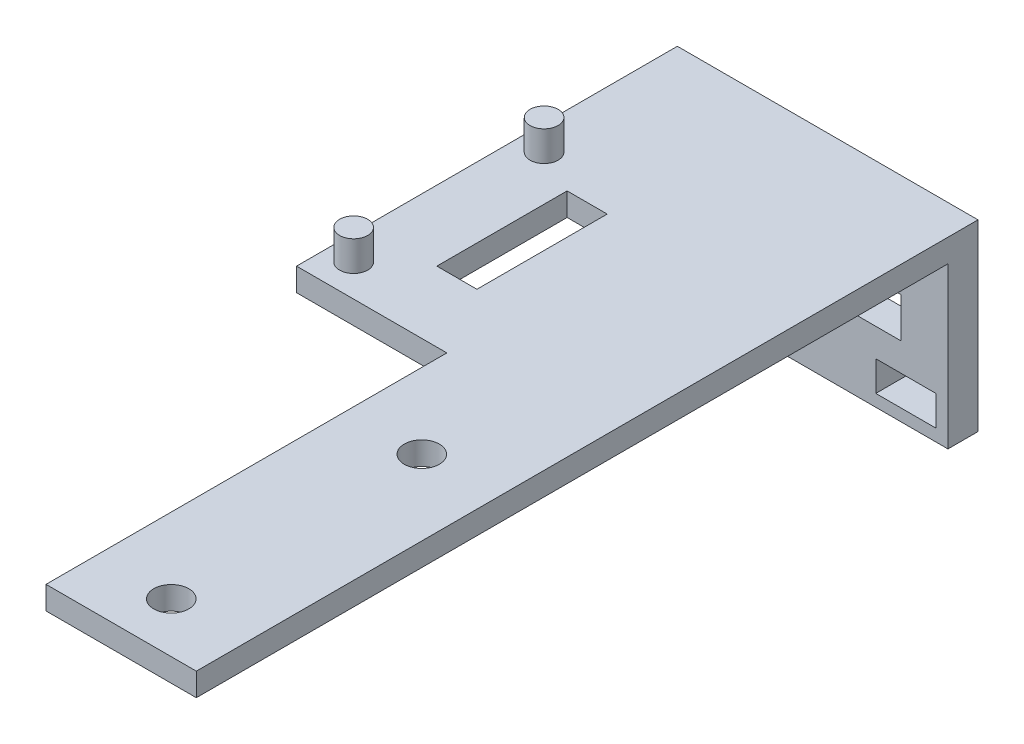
SolidWorks part; units mm, degrees
ref_plane "前视基准面" through (0, 0, 0) normal (0, 0, 1) x (1, 0, 0)
ref_plane "上视基准面" through (0, 0, 0) normal (0, 1, 0) x (1, 0, 0)
ref_plane "右视基准面" through (0, 0, 0) normal (1, 0, 0) x (0, 0, -1)
sketch "草图1" plane through (0, 0, 0) normal (0, 1, 0) x (1, 0, 0)
  line L0 (0, 47.4816) -> (0, -42.5568) construction
  line L2 (-7.5, 7.5) -> (-7.5, -32.5)
  line L3 (-7.5, -32.5) -> (7.5, -32.5)
  line L4 (7.5, 32.5) -> (7.5, -32.5)
  line L6 (-7.5, -32.5) -> (7.5, 32.5) construction
  line L9 (-7.5, 7.5) -> (-22.5, 7.5)
  line L10 (-22.5, 32.5) -> (-22.5, 7.5)
  line L12 (-15.5, 27.5) -> (-11.5, 27.5)
  line L13 (-15.5, 27.5) -> (-15.5, 14.5)
  line L14 (-15.5, 14.5) -> (-11.5, 14.5)
  line L15 (-11.5, 27.5) -> (-11.5, 14.5)
  line L16 (-15.5, 27.5) -> (-11.5, 14.5) construction
  line L17 (-15.5, 14.5) -> (-11.5, 27.5) construction
  line L19 (-22.5, 32.5) -> (-22.5, 45.5)
  line L20 (-22.5, 45.5) -> (7.5, 45.5)
  line L21 (7.5, 32.5) -> (7.5, 45.5)
  circle A0 centre (0, -27.5) radius 1.75
  circle A1 centre (0, -2.5) radius 1.75
  point P0 (0, 0)
  point P15 (-13.5, 21)
  point P22 (-15, 7.5)
  dimension "D5" = 3.5
  dimension "D6" = 3.5
  dimension "D10" = 22.5
  dimension "D11" = 48
  dimension "D1" = 15
  dimension "D2" = 65
  dimension "D3" = 25
  dimension "D4" = 13
  dimension "D7" = 7
  dimension "D8" = 20
  dimension "D9" = 7.5
  dimension "D12" = 7
  dimension "D13" = 11
  dimension "D14" = 38
  dimension "D15" = 73
extrude "凸台-拉伸1" add sketch "草图1" against normal blind 2.3
sketch "草图2" plane through (0, 0, 0) normal (0, 1, 0) x (1, 0, 0)
  line L0 (-55.6953, 0) -> (33.5451, 0) construction
  line L1 (0, 34.498) -> (0, -38.2164) construction
  line L3 (7.5, 45.5) -> (-22.5, 45.5) construction
  line L4 (-22.5, 45.5) -> (-22.5, 7.5) construction
  line L5 (-22.5, 45.5) -> (-22.5, 20.5) construction
  line L6 (-22.5, 7.5) -> (-7.5, 7.5) construction
  line L7 (-22.5, 7.5) -> (7.5, 7.5) construction
  circle A0 centre (-20, 29.7) radius 1.4
  circle A1 centre (-20, 10.7) radius 1.4
  dimension "D1" = 2.8
  dimension "D5" = 2.8
  dimension "D2" = 2.5
  dimension "D3" = 2.5
  dimension "D4" = 15.8
  dimension "D6" = 34.8
extrude "凸台-拉伸2" add sketch "草图2" along normal blind 3
sketch "草图3" plane through (0, 0, 0) normal (0, 1, 0) x (1, 0, 0)
  line L0 (7.5, 45.5) -> (-22.5, 45.5) construction
  line L1 (22.5, 45.5) -> (-22.5, 45.5) construction
  line L2 (-22.5, 45.5) -> (-22.5, 7.5) construction
  line L3 (-22.5, 45.5) -> (-22.5, 13.5) construction
  line L4 (7.5, -32.5) -> (7.5, 45.5) construction
  line L5 (-22.5, 45.5) -> (7.5, 45.5)
  line L7 (-22.5, 42.5) -> (7.5, 42.5)
  line L8 (7.5, 45.5) -> (7.5, 42.5)
  line L9 (-22.5, 45.5) -> (-22.5, 42.5)
  dimension "D1" = 3
  dimension "D2" = 30
extrude "凸台-拉伸3" add sketch "草图3" against normal blind 16 from surface at -2.3
ref_plane "基准面1" through (0, 0, -45.5) normal (0, 0, -1) x (-1, 0, 0)
sketch "草图4" plane through (0, 0, -45.5) normal (0, 0, -1) x (-1, 0, 0)
  line L0 (-7.5, -18.3) -> (22.5, -18.3) construction
  line L1 (-7.5, -18.3) -> (37.5, -18.3) construction
  line L2 (-7.5, -18.3) -> (-7.5, 0) construction
  line L3 (-7.5, -18.3) -> (-7.5, 0) construction
  line L9 (-2.8, -7.3) -> (15.2, -7.3)
  line L10 (-2.8, -7.3) -> (-2.8, -11.3)
  line L11 (-2.8, -11.3) -> (15.2, -11.3)
  line L12 (15.2, -7.3) -> (15.2, -11.3)
  line L13 (-2.8, -7.3) -> (15.2, -11.3) construction
  line L14 (-2.8, -11.3) -> (15.2, -7.3) construction
  line L15 (-6.3, -14.1) -> (-0.3, -14.1)
  line L16 (-6.3, -14.1) -> (-6.3, -17.1)
  line L17 (-6.3, -17.1) -> (-0.3, -17.1)
  line L18 (-0.3, -14.1) -> (-0.3, -17.1)
  line L19 (-6.3, -14.1) -> (-0.3, -17.1) construction
  line L20 (-6.3, -17.1) -> (-0.3, -14.1) construction
  line L21 (12.7, -14.1) -> (18.7, -14.1)
  line L22 (12.7, -14.1) -> (12.7, -17.1)
  line L23 (12.7, -17.1) -> (18.7, -17.1)
  line L24 (18.7, -14.1) -> (18.7, -17.1)
  line L25 (12.7, -14.1) -> (18.7, -17.1) construction
  line L26 (12.7, -17.1) -> (18.7, -14.1) construction
  point P8 (-3.3, -15.6)
  point P11 (6.2, -9.3)
  point P14 (15.7, -15.6)
  dimension "D3" = 1.2
  dimension "D5" = 3
  dimension "D7" = 6
  dimension "D8" = 19
  dimension "D2" = 1.2
  dimension "D4" = 6
  dimension "D6" = 3
  dimension "D9" = 1.2
  dimension "D10" = 3.5
  dimension "D11" = 3.5
  dimension "D14" = 7
  dimension "D15" = 11
extrude "切除-拉伸1" cut sketch "草图4" against normal through all
